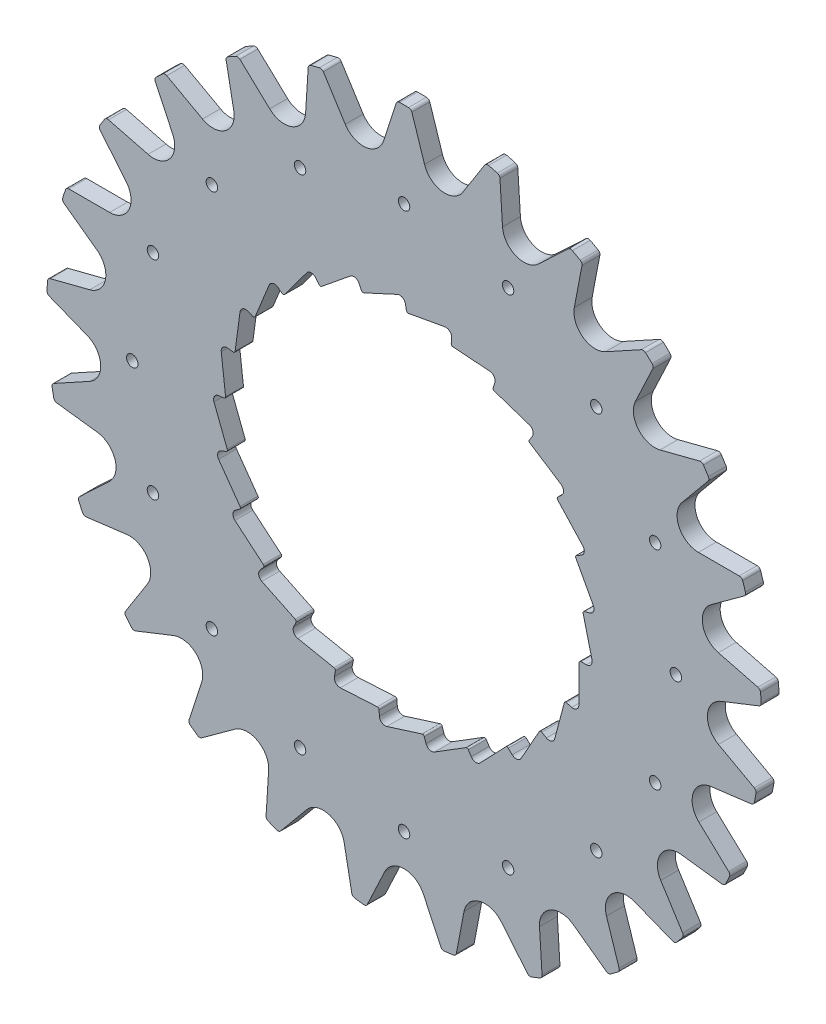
SolidWorks part; units mm, degrees
ref_plane "Plane1" through (0, 0, 0) normal (0, 0, 1) x (1, 0, 0)
ref_plane "Plane2" through (0, 0, 0) normal (0, 1, 0) x (1, 0, 0)
ref_plane "Plane3" through (0, 0, 0) normal (1, 0, 0) x (0, 0, -1)
sketch "Esquisse3" plane through (0, 0, 0) normal (0, 0, 1) x (1, 0, 0)
  line L0 (0, -117.2345) -> (0, 168.6891) construction
  line L1 (0, 0) -> (-19.921, 157.6909) construction
  line L2 (0, 106.0263) -> (-10.5401, 73.5871) construction
  line L3 (-5.7249, 88.4069) -> (-2.1954, 99.2694)
  line L4 (5.7249, 88.4069) -> (2.1954, 99.2694)
  line L5 (16.4409, 87.0532) -> (22.5608, 96.6966)
  line L6 (27.5309, 84.2057) -> (26.8138, 95.6047)
  line L7 (37.5736, 80.2296) -> (45.8995, 88.0481)
  line L8 (47.6071, 74.7136) -> (49.7473, 85.9328)
  line L9 (56.3455, 68.3648) -> (66.3542, 73.8672)
  line L10 (64.692, 60.5269) -> (69.555, 70.8614)
  line L11 (71.5769, 52.2045) -> (82.6395, 55.0449)
  line L12 (77.712, 42.5371) -> (84.9923, 51.3375)
  line L13 (82.3109, 32.7639) -> (93.7324, 32.7639)
  line L14 (85.8491, 21.8746) -> (95.0892, 28.5879)
  line L15 (87.873, 11.2647) -> (98.9357, 8.4243)
  line L16 (88.5919, -0.1625) -> (99.2114, 4.0421)
  line L17 (87.9137, -10.9423) -> (97.9224, -16.4447)
  line L18 (85.7683, -22.1893) -> (97.0997, -20.7578)
  line L19 (82.4305, -32.4618) -> (90.7564, -40.2804)
  line L20 (77.5554, -42.8219) -> (88.8869, -44.2533)
  line L21 (71.7679, -51.9416) -> (77.8878, -61.5851)
  line L22 (64.4695, -60.7638) -> (75.089, -64.9683)
  line L23 (56.5958, -68.1577) -> (60.1252, -79.0202)
  line L24 (47.3328, -74.8877) -> (56.5729, -81.6011)
  line L25 (37.8676, -80.0912) -> (38.5848, -91.4901)
  line L26 (27.2219, -84.3061) -> (34.5022, -93.1065)
  line L27 (16.7601, -86.9923) -> (14.6199, -98.2115)
  line L28 (5.4006, -88.4273) -> (10.2636, -98.7618)
  line L29 (-5.4006, -88.4273) -> (-10.2636, -98.7618)
  line L30 (-16.7601, -86.9923) -> (-14.6199, -98.2115)
  line L31 (-27.2219, -84.3061) -> (-34.5022, -93.1065)
  line L32 (-37.8676, -80.0912) -> (-38.5848, -91.4901)
  line L33 (-47.3328, -74.8877) -> (-56.5729, -81.6011)
  line L34 (-56.5958, -68.1577) -> (-60.1252, -79.0202)
  line L35 (-64.4695, -60.7638) -> (-75.089, -64.9683)
  line L36 (-71.7679, -51.9416) -> (-77.8878, -61.5851)
  line L37 (-77.5554, -42.8219) -> (-88.8869, -44.2533)
  line L38 (-82.4305, -32.4618) -> (-90.7564, -40.2804)
  line L39 (-85.7683, -22.1893) -> (-97.0997, -20.7578)
  line L40 (-87.9137, -10.9423) -> (-97.9224, -16.4447)
  line L41 (-88.5919, -0.1625) -> (-99.2114, 4.0421)
  line L42 (-87.873, 11.2647) -> (-98.9357, 8.4243)
  line L43 (-85.8491, 21.8746) -> (-95.0892, 28.5879)
  line L44 (-82.3109, 32.7639) -> (-93.7324, 32.7639)
  line L45 (-77.712, 42.5371) -> (-84.9923, 51.3375)
  line L46 (-71.5769, 52.2045) -> (-82.6395, 55.0449)
  line L47 (-64.692, 60.5269) -> (-69.555, 70.8614)
  line L48 (-56.3455, 68.3648) -> (-66.3542, 73.8672)
  line L49 (-47.6071, 74.7136) -> (-49.7473, 85.9328)
  line L50 (-37.5736, 80.2296) -> (-45.8995, 88.0481)
  line L51 (-27.5309, 84.2057) -> (-26.8138, 95.6047)
  line L52 (-16.4409, 87.0532) -> (-22.5608, 96.6966)
  line L53 (0, 0) -> (35.2659, 137.3516) construction
  line L54 (-0.552, 50) -> (15.8028, 50) construction
  line L55 (0, 54) -> (15.0779, 54) construction
  line L56 (0.75, 39.8519) -> (0.75, 54.181) construction
  line L57 (0.3779, 51.9844) -> (0.6584, 50.4887)
  line L58 (1.2392, 50.0889) -> (11.4115, 51.9369)
  line L59 (13.294, 50.2572) -> (13.1937, 48.7387)
  line L60 (13.6568, 48.2071) -> (23.9692, 47.4673)
  line L61 (25.3748, 45.3722) -> (24.9, 43.9264)
  line L62 (25.2164, 43.2962) -> (35.0208, 40.0151)
  line L63 (35.8613, 37.6363) -> (35.0418, 36.354)
  line L64 (35.1915, 35.6649) -> (43.8719, 30.0487)
  line L65 (44.0944, 27.5355) -> (42.9818, 26.4973)
  line L66 (42.9554, 25.7927) -> (49.9664, 18.1941)
  line L67 (49.5569, 15.7046) -> (48.221, 14.9757)
  line L68 (48.0203, 14.2998) -> (52.9213, 5.1964)
  line L69 (51.9055, 2.8869) -> (50.4304, 2.5131)
  line L70 (50.0678, 1.9084) -> (52.551, -8.1279)
  line L71 (50.9928, -10.1121) -> (49.471, -10.1073)
  line L72 (48.9695, -10.603) -> (48.8787, -20.9414)
  line L73 (46.876, -22.4758) -> (45.4032, -22.0927)
  line L74 (44.7941, -22.4481) -> (42.1351, -32.4391)
  line L75 (39.8137, -33.4273) -> (38.4825, -32.69)
  line L76 (37.8043, -32.8827) -> (32.7441, -41.8986)
  line L77 (30.2499, -42.2784) -> (29.1439, -41.2332)
  line L78 (28.439, -41.2511) -> (21.2956, -48.7254)
  line L79 (18.7853, -48.473) -> (17.974, -47.1855)
  line L80 (17.2868, -47.0276) -> (8.5091, -52.4906)
  line L81 (6.1404, -51.6218) -> (5.6747, -50.1731)
  line L82 (5.0484, -49.8492) -> (-4.8121, -52.9576)
  line L83 (-6.8903, -51.5271) -> (-6.9811, -50.008)
  line L84 (-7.5072, -49.5386) -> (-17.831, -50.0971)
  line L85 (-19.4881, -48.1947) -> (-19.1983, -46.7008)
  line L86 (-19.5911, -46.1153) -> (-29.7294, -44.0889)
  line L87 (-30.8614, -41.8341) -> (-30.2091, -40.4592)
  line L88 (-30.444, -39.7944) -> (-39.7599, -35.3103)
  line L89 (-40.2955, -32.8449) -> (-39.3219, -31.6754)
  line L90 (-39.384, -30.973) -> (-47.2921, -24.3131)
  line L91 (-47.1978, -21.7919) -> (-45.9638, -20.9013)
  line L92 (-45.8494, -20.2056) -> (-51.8527, -11.7882)
  line L93 (-51.1344, -9.3697) -> (-49.7177, -8.8139)
  line L94 (-49.4339, -8.1685) -> (-53.1553, 1.4774)
  line L95 (-51.8581, 3.6413) -> (-50.3477, 3.8273)
  line L96 (-49.9122, 4.3818) -> (-51.1179, 14.6502)
  line L97 (-49.3233, 16.4235) -> (-47.8141, 16.228)
  line L98 (-47.2544, 16.6568) -> (-45.8686, 26.9024)
  line L99 (-43.6894, 28.1737) -> (-42.2762, 27.6091)
  line L100 (-41.6274, 27.8852) -> (-37.7372, 37.4643)
  line L101 (-35.3103, 38.1537) -> (-34.0819, 37.2553)
  line L102 (-33.3849, 37.3615) -> (-27.2346, 45.6721)
  line L103 (-24.7125, 45.7363) -> (-23.7462, 44.5607)
  line L104 (-23.0446, 44.4902) -> (-15.0208, 51.0102)
  line L105 (-12.5619, 50.4452) -> (-11.9183, 49.0662)
  line L106 (-11.2563, 48.8234) -> (-1.8632, 53.1432)
  arc A0 (2.1954, 99.2694) -> (1.257, 99.9603) centre (1.2444, 98.9604) ccw
  arc A1 (-2.1954, 99.2694) -> (-1.257, 99.9603) centre (-1.2444, 98.9604) cw
  circle A2 centre (0, 0) radius 80 construction
  arc A3 (1.257, 99.9603) -> (-1.257, 99.9603) centre (0, 0) ccw
  arc A4 (-10.6533, 84.3297) -> (-5.7249, 88.4069) centre (-11.4014, 90.2513) ccw
  arc A5 (10.6533, 84.3297) -> (5.7249, 88.4069) centre (11.4014, 90.2513) cw
  arc A6 (26.8138, 95.6047) -> (26.0766, 96.5073) centre (25.8157, 95.5419) ccw
  arc A7 (22.5608, 96.6966) -> (23.6416, 97.1324) centre (23.4052, 96.1608) cw
  arc A8 (26.0766, 96.5073) -> (23.6416, 97.1324) centre (0, 0) ccw
  arc A9 (10.6533, 84.3297) -> (16.4409, 87.0532) centre (11.4014, 90.2513) ccw
  arc A10 (31.2906, 79.031) -> (27.5309, 84.2057) centre (33.4878, 84.5805) cw
  arc A11 (49.7473, 85.9328) -> (49.2577, 86.9903) centre (48.765, 86.1201) ccw
  arc A12 (45.8995, 88.0481) -> (47.0548, 88.2014) centre (46.5841, 87.3191) cw
  arc A13 (49.2577, 86.9903) -> (47.0548, 88.2014) centre (0, 0) ccw
  arc A14 (31.2906, 79.031) -> (37.5736, 80.2296) centre (33.4878, 84.5805) ccw
  arc A15 (49.9617, 68.7664) -> (47.6071, 74.7136) centre (53.47, 73.5952) cw
  arc A16 (69.555, 70.8614) -> (69.3438, 72.0075) centre (68.6502, 71.2872) ccw
  arc A17 (66.3542, 73.8672) -> (67.5112, 73.7284) centre (66.8359, 72.9908) cw
  arc A18 (69.3438, 72.0075) -> (67.5112, 73.7284) centre (0, 0) ccw
  arc A19 (49.9617, 68.7664) -> (56.3455, 68.3648) centre (53.47, 73.5952) ccw
  arc A20 (65.4936, 54.181) -> (64.692, 60.5269) centre (70.0925, 57.9856) cw
  arc A21 (84.9923, 51.3375) -> (85.0728, 52.5001) centre (84.2218, 51.975) ccw
  arc A22 (82.6395, 55.0449) -> (83.7258, 54.6227) centre (82.8882, 54.0763) cw
  arc A23 (85.0728, 52.5001) -> (83.7258, 54.6227) centre (0, 0) ccw
  arc A24 (65.4936, 54.181) -> (71.5769, 52.2045) centre (70.0925, 57.9856) ccw
  arc A25 (76.9103, 36.1912) -> (77.712, 42.5371) centre (82.3109, 38.7326) cw
  arc A26 (95.0892, 28.5879) -> (95.4563, 29.694) centre (94.5014, 29.397) ccw
  arc A27 (93.7324, 32.7639) -> (94.6795, 32.0849) centre (93.7324, 31.7639) cw
  arc A28 (95.4563, 29.694) -> (94.6795, 32.0849) centre (0, 0) ccw
  arc A29 (76.9103, 36.1912) -> (82.3109, 32.7639) centre (82.3109, 38.7326) ccw
  arc A30 (83.4944, 15.9274) -> (85.8491, 21.8746) centre (89.3573, 17.0458) cw
  arc A31 (99.2114, 4.0421) -> (99.842, 5.0221) centre (98.8432, 4.9718) ccw
  arc A32 (98.9357, 8.4243) -> (99.6841, 7.531) centre (98.687, 7.4557) cw
  arc A33 (99.842, 5.0221) -> (99.6841, 7.531) centre (0, 0) ccw
  arc A34 (83.4944, 15.9274) -> (87.873, 11.2647) centre (89.3573, 17.0458) ccw
  arc A35 (84.8323, -5.3372) -> (88.5919, -0.1625) centre (90.7891, -5.712) cw
  arc A36 (97.0997, -20.7578) -> (97.9542, -19.9654) centre (96.9743, -19.7657) ccw
  arc A37 (97.9224, -16.4447) -> (98.4253, -17.496) centre (97.4407, -17.321) cw
  arc A38 (97.9542, -19.9654) -> (98.4253, -17.496) centre (0, 0) ccw
  arc A39 (84.8323, -5.3372) -> (87.9137, -10.9423) centre (90.7891, -5.712) ccw
  arc A40 (80.8398, -26.2664) -> (85.7683, -22.1893) centre (86.5163, -28.1109) cw
  arc A41 (88.8869, -44.2533) -> (89.9116, -43.6984) centre (89.0122, -43.2612) ccw
  arc A42 (90.7564, -40.2804) -> (90.982, -41.4237) centre (90.0719, -41.0093) cw
  arc A43 (89.9116, -43.6984) -> (90.982, -41.4237) centre (0, 0) ccw
  arc A44 (80.8398, -26.2664) -> (82.4305, -32.4618) centre (86.5163, -28.1109) ccw
  arc A45 (71.7679, -45.5453) -> (77.5554, -42.8219) centre (76.8074, -48.7434) cw
  arc A46 (75.089, -64.9683) -> (76.2195, -64.6856) centre (75.4571, -64.0385) ccw
  arc A47 (77.8878, -61.5851) -> (77.8219, -62.7486) centre (77.0435, -62.1209) cw
  arc A48 (76.2195, -64.6856) -> (77.8219, -62.7486) centre (0, 0) ccw
  arc A49 (71.7679, -45.5453) -> (71.7679, -51.9416) centre (76.8074, -48.7434) ccw
  arc A50 (58.1865, -61.9623) -> (64.4695, -60.7638) centre (62.2723, -66.3133) cw
  arc A51 (56.5729, -81.6011) -> (57.7383, -81.6084) centre (57.1607, -80.7921) ccw
  arc A52 (60.1252, -79.0202) -> (59.7721, -80.1308) centre (59.1742, -79.3292) cw
  arc A53 (57.7383, -81.6084) -> (59.7721, -80.1308) centre (0, 0) ccw
  arc A54 (58.1865, -61.9623) -> (56.5958, -68.1577) centre (62.2723, -66.3133) ccw
  arc A55 (40.9491, -74.4861) -> (47.3328, -74.8877) centre (43.8245, -79.7164) cw
  arc A56 (34.5022, -93.1065) -> (35.6291, -93.4034) centre (35.2727, -92.4691) ccw
  arc A57 (38.5848, -91.4901) -> (37.9665, -92.478) centre (37.5867, -91.5529) cw
  arc A58 (35.6291, -93.4034) -> (37.9665, -92.478) centre (0, 0) ccw
  arc A59 (40.9491, -74.4861) -> (37.8676, -80.0912) centre (43.8245, -79.7164) ccw
  arc A60 (21.1386, -82.3296) -> (27.2219, -84.3061) centre (22.623, -88.1107) cw
  arc A61 (10.2636, -98.7618) -> (11.2813, -99.3296) centre (11.1685, -98.336) ccw
  arc A62 (14.6199, -98.2115) -> (13.7754, -99.0145) centre (13.6376, -98.0241) cw
  arc A63 (11.2813, -99.3296) -> (13.7754, -99.0145) centre (0, 0) ccw
  arc A64 (21.1386, -82.3296) -> (16.7601, -86.9923) centre (22.623, -88.1107) ccw
  arc A65 (0, -85) -> (5.4006, -88.4273) centre (0, -90.9687) cw
  arc A66 (-14.6199, -98.2115) -> (-13.7754, -99.0145) centre (-13.6376, -98.0241) ccw
  arc A67 (-10.2636, -98.7618) -> (-11.2813, -99.3296) centre (-11.1685, -98.336) cw
  arc A68 (-13.7754, -99.0145) -> (-11.2813, -99.3296) centre (0, 0) ccw
  arc A69 (0, -85) -> (-5.4006, -88.4273) centre (0, -90.9687) ccw
  arc A70 (-21.1386, -82.3296) -> (-16.7601, -86.9923) centre (-22.623, -88.1107) cw
  arc A71 (-38.5848, -91.4901) -> (-37.9665, -92.478) centre (-37.5867, -91.5529) ccw
  arc A72 (-34.5022, -93.1065) -> (-35.6291, -93.4034) centre (-35.2727, -92.4691) cw
  arc A73 (-37.9665, -92.478) -> (-35.6291, -93.4034) centre (0, 0) ccw
  arc A74 (-21.1386, -82.3296) -> (-27.2219, -84.3061) centre (-22.623, -88.1107) ccw
  arc A75 (-40.9491, -74.4861) -> (-37.8676, -80.0912) centre (-43.8245, -79.7164) cw
  arc A76 (-60.1252, -79.0202) -> (-59.7721, -80.1308) centre (-59.1742, -79.3292) ccw
  arc A77 (-56.5729, -81.6011) -> (-57.7383, -81.6084) centre (-57.1607, -80.7921) cw
  arc A78 (-59.7721, -80.1308) -> (-57.7383, -81.6084) centre (0, 0) ccw
  arc A79 (-40.9491, -74.4861) -> (-47.3328, -74.8877) centre (-43.8245, -79.7164) ccw
  arc A80 (-58.1865, -61.9623) -> (-56.5958, -68.1577) centre (-62.2723, -66.3133) cw
  arc A81 (-77.8878, -61.5851) -> (-77.8219, -62.7486) centre (-77.0435, -62.1209) ccw
  arc A82 (-75.089, -64.9683) -> (-76.2195, -64.6856) centre (-75.4571, -64.0385) cw
  arc A83 (-77.8219, -62.7486) -> (-76.2195, -64.6856) centre (0, 0) ccw
  arc A84 (-58.1865, -61.9623) -> (-64.4695, -60.7638) centre (-62.2723, -66.3133) ccw
  arc A85 (-71.7679, -45.5453) -> (-71.7679, -51.9416) centre (-76.8074, -48.7434) cw
  arc A86 (-90.7564, -40.2804) -> (-90.982, -41.4237) centre (-90.0719, -41.0093) ccw
  arc A87 (-88.8869, -44.2533) -> (-89.9116, -43.6984) centre (-89.0122, -43.2612) cw
  arc A88 (-90.982, -41.4237) -> (-89.9116, -43.6984) centre (0, 0) ccw
  arc A89 (-71.7679, -45.5453) -> (-77.5554, -42.8219) centre (-76.8074, -48.7434) ccw
  arc A90 (-80.8398, -26.2664) -> (-82.4305, -32.4618) centre (-86.5163, -28.1109) cw
  arc A91 (-97.9224, -16.4447) -> (-98.4253, -17.496) centre (-97.4407, -17.321) ccw
  arc A92 (-97.0997, -20.7578) -> (-97.9542, -19.9654) centre (-96.9743, -19.7657) cw
  arc A93 (-98.4253, -17.496) -> (-97.9542, -19.9654) centre (0, 0) ccw
  arc A94 (-80.8398, -26.2664) -> (-85.7683, -22.1893) centre (-86.5163, -28.1109) ccw
  arc A95 (-84.8323, -5.3372) -> (-87.9137, -10.9423) centre (-90.7891, -5.712) cw
  arc A96 (-98.9357, 8.4243) -> (-99.6841, 7.531) centre (-98.687, 7.4557) ccw
  arc A97 (-99.2114, 4.0421) -> (-99.842, 5.0221) centre (-98.8432, 4.9718) cw
  arc A98 (-99.6841, 7.531) -> (-99.842, 5.0221) centre (0, 0) ccw
  arc A99 (-84.8323, -5.3372) -> (-88.5919, -0.1625) centre (-90.7891, -5.712) ccw
  arc A100 (-83.4944, 15.9274) -> (-87.873, 11.2647) centre (-89.3573, 17.0458) cw
  arc A101 (-93.7324, 32.7639) -> (-94.6795, 32.0849) centre (-93.7324, 31.7639) ccw
  arc A102 (-95.0892, 28.5879) -> (-95.4563, 29.694) centre (-94.5014, 29.397) cw
  arc A103 (-94.6795, 32.0849) -> (-95.4563, 29.694) centre (0, 0) ccw
  arc A104 (-83.4944, 15.9274) -> (-85.8491, 21.8746) centre (-89.3573, 17.0458) ccw
  arc A105 (-76.9103, 36.1912) -> (-82.3109, 32.7639) centre (-82.3109, 38.7326) cw
  arc A106 (-82.6395, 55.0449) -> (-83.7258, 54.6227) centre (-82.8882, 54.0763) ccw
  arc A107 (-84.9923, 51.3375) -> (-85.0728, 52.5001) centre (-84.2218, 51.975) cw
  arc A108 (-83.7258, 54.6227) -> (-85.0728, 52.5001) centre (0, 0) ccw
  arc A109 (-76.9103, 36.1912) -> (-77.712, 42.5371) centre (-82.3109, 38.7326) ccw
  arc A110 (-65.4936, 54.181) -> (-71.5769, 52.2045) centre (-70.0925, 57.9856) cw
  arc A111 (-66.3542, 73.8672) -> (-67.5112, 73.7284) centre (-66.8359, 72.9908) ccw
  arc A112 (-69.555, 70.8614) -> (-69.3438, 72.0075) centre (-68.6502, 71.2872) cw
  arc A113 (-67.5112, 73.7284) -> (-69.3438, 72.0075) centre (0, 0) ccw
  arc A114 (-65.4936, 54.181) -> (-64.692, 60.5269) centre (-70.0925, 57.9856) ccw
  arc A115 (-49.9617, 68.7664) -> (-56.3455, 68.3648) centre (-53.47, 73.5952) cw
  arc A116 (-45.8995, 88.0481) -> (-47.0548, 88.2014) centre (-46.5841, 87.3191) ccw
  arc A117 (-49.7473, 85.9328) -> (-49.2577, 86.9903) centre (-48.765, 86.1201) cw
  arc A118 (-47.0548, 88.2014) -> (-49.2577, 86.9903) centre (0, 0) ccw
  arc A119 (-49.9617, 68.7664) -> (-47.6071, 74.7136) centre (-53.47, 73.5952) ccw
  arc A120 (-31.2906, 79.031) -> (-37.5736, 80.2296) centre (-33.4878, 84.5805) cw
  arc A121 (-22.5608, 96.6966) -> (-23.6416, 97.1324) centre (-23.4052, 96.1608) ccw
  arc A122 (-26.8138, 95.6047) -> (-26.0766, 96.5073) centre (-25.8157, 95.5419) cw
  arc A123 (-23.6416, 97.1324) -> (-26.0766, 96.5073) centre (0, 0) ccw
  arc A124 (-31.2906, 79.031) -> (-27.5309, 84.2057) centre (-33.4878, 84.5805) ccw
  arc A125 (-10.6533, 84.3297) -> (-16.4409, 87.0532) centre (-11.4014, 90.2513) cw
  circle A126 centre (0, 0) radius 100 construction
  circle A127 centre (0, 0) radius 72 construction
  circle A128 centre (0, 0) radius 62 construction
  circle A129 centre (0, 0) radius 76 construction
  circle A130 centre (0, 76) radius 1.6
  circle A131 centre (9.9858, 66.2517) radius 5 construction
  circle A132 centre (19.7486, 64.0234) radius 5 construction
  circle A133 centre (29.0702, 60.3649) radius 5 construction
  circle A134 centre (37.7424, 55.358) radius 5 construction
  circle A135 centre (45.5716, 49.1145) radius 5 construction
  circle A136 centre (52.3827, 41.7738) radius 5 construction
  circle A137 centre (58.0237, 33.5) radius 5 construction
  circle A138 centre (0, 0) radius 67 construction
  circle A139 centre (0, 67) radius 5 construction
  circle A140 centre (0, 0) radius 54 construction
  circle A141 centre (0, 0) radius 61 construction
  circle A142 centre (0, 0) radius 49 construction
  circle A143 centre (62.3685, 24.4778) radius 5 construction
  circle A144 centre (65.3202, 14.9089) radius 5 construction
  circle A145 centre (66.8127, 5.0069) radius 5 construction
  circle A146 centre (66.8127, -5.0069) radius 5 construction
  circle A147 centre (65.3202, -14.9089) radius 5 construction
  circle A148 centre (62.3685, -24.4778) radius 5 construction
  circle A149 centre (58.0237, -33.5) radius 5 construction
  circle A150 centre (52.3827, -41.7738) radius 5 construction
  circle A151 centre (45.5716, -49.1145) radius 5 construction
  circle A152 centre (37.7424, -55.358) radius 5 construction
  circle A153 centre (29.0702, -60.3649) radius 5 construction
  circle A154 centre (19.7486, -64.0234) radius 5 construction
  circle A155 centre (9.9858, -66.2517) radius 5 construction
  circle A156 centre (0, -67) radius 5 construction
  circle A157 centre (-9.9858, -66.2517) radius 5 construction
  circle A158 centre (-19.7486, -64.0234) radius 5 construction
  circle A159 centre (-29.0702, -60.3649) radius 5 construction
  circle A160 centre (-37.7424, -55.358) radius 5 construction
  circle A161 centre (-45.5716, -49.1145) radius 5 construction
  circle A162 centre (-52.3827, -41.7738) radius 5 construction
  circle A163 centre (-58.0237, -33.5) radius 5 construction
  circle A164 centre (-62.3685, -24.4778) radius 5 construction
  circle A165 centre (-65.3202, -14.9089) radius 5 construction
  circle A166 centre (-66.8127, -5.0069) radius 5 construction
  circle A167 centre (-66.8127, 5.0069) radius 5 construction
  circle A168 centre (-65.3202, 14.9089) radius 5 construction
  circle A169 centre (-62.3685, 24.4778) radius 5 construction
  circle A170 centre (-58.0237, 33.5) radius 5 construction
  circle A171 centre (-52.3827, 41.7738) radius 5 construction
  circle A172 centre (-45.5716, 49.1145) radius 5 construction
  circle A173 centre (-37.7424, 55.358) radius 5 construction
  circle A174 centre (-29.0702, 60.3649) radius 5 construction
  circle A175 centre (-19.7486, 64.0234) radius 5 construction
  circle A176 centre (-9.9858, 66.2517) radius 5 construction
  circle A178 centre (29.0839, 70.2148) radius 1.6
  circle A180 centre (53.7401, 53.7401) radius 1.6
  circle A182 centre (70.2148, 29.0839) radius 1.6
  circle A184 centre (76, 0) radius 1.6
  circle A186 centre (70.2148, -29.0839) radius 1.6
  circle A188 centre (53.7401, -53.7401) radius 1.6
  circle A190 centre (29.0839, -70.2148) radius 1.6
  circle A192 centre (0, -76) radius 1.6
  circle A194 centre (-29.0839, -70.2148) radius 1.6
  circle A196 centre (-53.7401, -53.7401) radius 1.6
  circle A198 centre (-70.2148, -29.0839) radius 1.6
  circle A200 centre (-76, 0) radius 1.6
  circle A202 centre (-70.2148, 29.0839) radius 1.6
  circle A204 centre (-53.7401, 53.7401) radius 1.6
  circle A206 centre (-29.0839, 70.2148) radius 1.6
  arc A207 (0.6584, 50.4887) -> (1.2392, 50.0889) centre (1.1498, 50.5808) ccw
  arc A208 (13.1937, 48.7387) -> (13.6568, 48.2071) centre (13.6926, 48.7058) ccw
  arc A209 (24.9, 43.9264) -> (25.2164, 43.2962) centre (25.3751, 43.7704) ccw
  arc A210 (35.0418, 36.354) -> (35.1915, 35.6649) centre (35.4631, 36.0847) ccw
  arc A211 (42.9818, 26.4973) -> (42.9554, 25.7927) centre (43.3229, 26.1317) ccw
  arc A212 (48.221, 14.9757) -> (48.0203, 14.2998) centre (48.4605, 14.5368) ccw
  arc A213 (50.4304, 2.5131) -> (50.0678, 1.9084) centre (50.5532, 2.0285) ccw
  arc A214 (49.471, -10.1073) -> (48.9695, -10.603) centre (49.4694, -10.6073) ccw
  arc A215 (45.4032, -22.0927) -> (44.7941, -22.4481) centre (45.2773, -22.5766) ccw
  arc A216 (38.4825, -32.69) -> (37.8043, -32.8827) centre (38.2403, -33.1274) ccw
  arc A217 (29.1439, -41.2332) -> (28.439, -41.2511) centre (28.8004, -41.5966) ccw
  arc A218 (17.974, -47.1855) -> (17.2868, -47.0276) centre (17.551, -47.4521) ccw
  arc A219 (5.6747, -50.1731) -> (5.0484, -49.8492) centre (5.1987, -50.3261) ccw
  arc A220 (-6.9811, -50.008) -> (-7.5072, -49.5386) centre (-7.4802, -50.0379) ccw
  arc A221 (-19.1983, -46.7008) -> (-19.5911, -46.1153) centre (-19.6891, -46.6056) ccw
  arc A222 (-30.2091, -40.4592) -> (-30.444, -39.7944) centre (-30.6609, -40.2449) ccw
  arc A223 (-39.3219, -31.6754) -> (-39.384, -30.973) centre (-39.7061, -31.3555) ccw
  arc A224 (-45.9638, -20.9013) -> (-45.8494, -20.2056) centre (-46.2565, -20.4959) ccw
  arc A225 (-49.7177, -8.8139) -> (-49.4339, -8.1685) centre (-49.9003, -8.3485) ccw
  arc A226 (-50.3477, 3.8273) -> (-49.9122, 4.3818) centre (-50.4088, 4.3235) ccw
  arc A227 (-47.8141, 16.228) -> (-47.2544, 16.6568) centre (-47.7499, 16.7239) ccw
  arc A228 (-42.2762, 27.6091) -> (-41.6274, 27.8852) centre (-42.0907, 28.0734) ccw
  arc A229 (-34.0819, 37.2553) -> (-33.3849, 37.3615) centre (-33.7868, 37.6589) ccw
  arc A230 (-23.7462, 44.5607) -> (-23.0446, 44.4902) centre (-23.3599, 44.8782) ccw
  arc A231 (-11.9183, 49.0662) -> (-11.2563, 48.8234) centre (-11.4653, 49.2777) ccw
  arc A232 (-37.7372, 37.4643) -> (-35.3103, 38.1537) centre (-36.2548, 36.8622) cw
  arc A233 (-45.8686, 26.9024) -> (-43.6894, 28.1737) centre (-44.283, 26.6879) cw
  arc A234 (-51.1179, 14.6502) -> (-49.3233, 16.4235) centre (-49.5288, 14.8367) cw
  arc A235 (-53.1553, 1.4774) -> (-51.8581, 3.6413) centre (-51.6625, 2.0533) cw
  arc A236 (-51.8527, -11.7882) -> (-51.1344, -9.3697) centre (-50.5501, -10.8592) cw
  arc A237 (-47.2921, -24.3131) -> (-47.1978, -21.7919) centre (-46.2614, -23.0893) cw
  arc A238 (-39.7599, -35.3103) -> (-40.2955, -32.8449) centre (-39.0659, -33.8686) cw
  arc A239 (-29.7294, -44.0889) -> (-30.8614, -41.8341) centre (-29.4158, -42.5199) cw
  arc A240 (-17.831, -50.0971) -> (-19.4881, -48.1947) centre (-17.9174, -48.4995) cw
  arc A241 (-4.8121, -52.9576) -> (-6.8903, -51.5271) centre (-5.2932, -51.4317) cw
  arc A242 (8.5091, -52.4906) -> (6.1404, -51.6218) centre (7.6637, -51.1322) cw
  arc A243 (21.2956, -48.7254) -> (18.7853, -48.473) centre (20.1389, -47.6199) cw
  arc A244 (32.7441, -41.8986) -> (30.2499, -42.2784) centre (31.3488, -41.1155) cw
  arc A245 (42.1351, -32.4391) -> (39.8137, -33.4273) centre (40.589, -32.0276) cw
  arc A246 (48.8787, -20.9414) -> (46.876, -22.4758) centre (47.2787, -20.9274) cw
  arc A247 (52.551, -8.1279) -> (50.9928, -10.1121) centre (50.9978, -8.5121) cw
  arc A248 (52.9213, 5.1964) -> (51.9055, 2.8869) centre (51.5125, 4.4379) cw
  arc A249 (49.9664, 18.1941) -> (49.5569, 15.7046) centre (48.7905, 17.1091) cw
  arc A250 (43.8719, 30.0487) -> (44.0944, 27.5355) centre (43.0028, 28.7053) cw
  arc A251 (35.0208, 40.0151) -> (35.8613, 37.6363) centre (34.513, 38.4978) cw
  arc A252 (-27.2346, 45.6721) -> (-24.7125, 45.7363) centre (-25.9485, 44.7203) cw
  arc A253 (-15.0208, 51.0102) -> (-12.5619, 50.4452) centre (-14.0118, 49.7685) cw
  arc A254 (23.9692, 47.4673) -> (25.3748, 45.3722) centre (23.8547, 45.8714) cw
  arc A255 (11.4115, 51.9369) -> (13.294, 50.2572) centre (11.6975, 50.3627) cw
  arc A256 (0.3779, 51.9844) -> (-1.8632, 53.1432) centre (-1.1947, 51.6895) ccw
  circle A257 centre (0, 58) radius 1.6
  circle A258 centre (-22.1956, 53.585) radius 1.6
  circle A259 centre (-41.0122, 41.0122) radius 1.6
  circle A260 centre (-53.585, 22.1956) radius 1.6
  circle A261 centre (-53.585, -22.1956) radius 1.6
  circle A262 centre (-41.0122, -41.0122) radius 1.6
  circle A263 centre (-22.1956, -53.585) radius 1.6
  circle A264 centre (0, -58) radius 1.6
  circle A265 centre (22.1956, -53.585) radius 1.6
  circle A266 centre (41.0122, -41.0122) radius 1.6
  circle A267 centre (53.585, -22.1956) radius 1.6
  circle A268 centre (58, 0) radius 1.6
  circle A269 centre (53.585, 22.1956) radius 1.6
  circle A270 centre (41.0122, 41.0122) radius 1.6
  circle A271 centre (22.1956, 53.585) radius 1.6
  circle A272 centre (-58, 0) radius 1.6
  point P472 (0.75, 50)
  point P616 (13.4293, 52.3035)
  dimension "D7" = 42
  dimension "D1" = 7.2
  dimension "D3" = 1
  dimension "D4" = 14.4
  dimension "D8" = 16
  dimension "D9" = 25
  dimension "D10" = 1.6
  dimension "D2" = 18
  dimension "D5" = 4
  dimension "D6" = 0.75
extrude "Boss.-Extru.1" add sketch "Esquisse3" along normal blind 5
